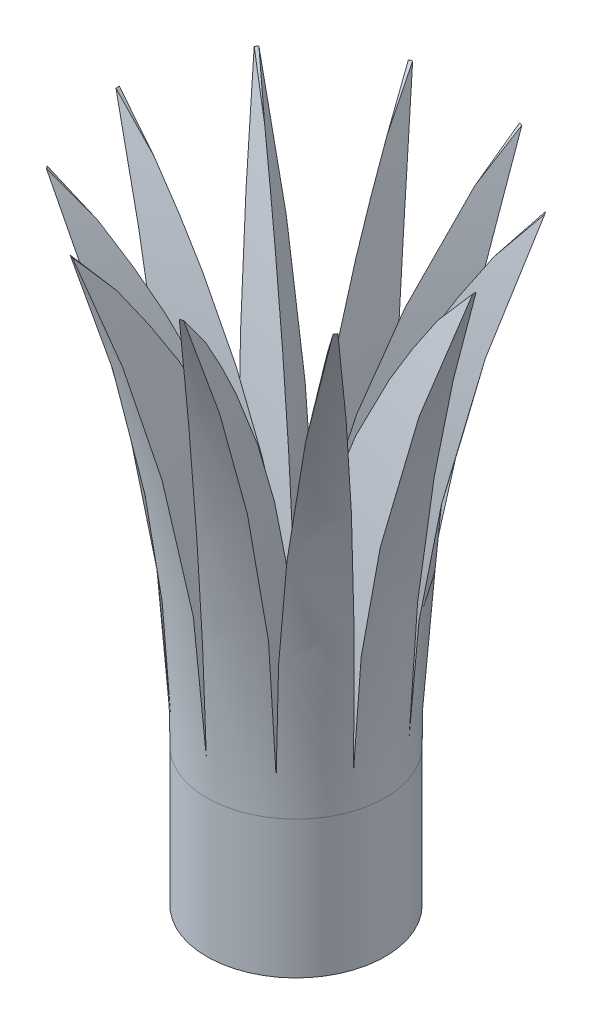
SolidWorks part; units mm, degrees
ref_plane "Plan de face" through (0, 0, 0) normal (0, 0, 1) x (1, 0, 0)
ref_plane "Plan de dessus" through (0, 0, 0) normal (0, 1, 0) x (1, 0, 0)
ref_plane "Plan de droite" through (0, 0, 0) normal (1, 0, 0) x (0, 0, -1)
sketch "Esquisse1" plane through (0, 0, 0) normal (0, 0, 1) x (1, 0, 0)
  line L0 (0, 0) -> (5, 0)
  line L1 (0, 0) -> (0, 35) construction
  line L2 (5, 0) -> (5, 35) construction
  line L3 (5, 8) -> (5, 0)
  line L4 (0, 10) -> (0, 0)
  arc A0 (5, 8) -> (10, 35) centre (80.4, 8) cw
  arc A1 (10, 35) -> (0, 10) centre (36.25, 10) ccw
  dimension "D1" = 5
  dimension "D2" = 35
  dimension "D3" = 8
  dimension "D4" = 10
  dimension "D5" = 10
revolve "Révolution1" add sketch "Esquisse1" angle 360 about L4
sketch "Esquisse2" plane through (0, 0, 0) normal (0, 0, 1) x (1, 0, 0)
  line L0 (-10, 35) -> (10, 35) construction
  line L1 (0, 10) -> (0, 35) construction
  line L2 (-3, 35) -> (3, 35)
  arc A0 (0, 10) -> (-3, 35) centre (-105.6667, 10) ccw
  arc A1 (0, 10) -> (3, 35) centre (105.6667, 10) cw
  dimension "D1" = 3
  dimension "D2" = 3
extrude "Enlèv. mat.-Extru.1" cut sketch "Esquisse2" against normal through all
pattern_circular "Répétition circulaire1" count 10 every 36 about axis through (0, 0, 0) along (0, 1, 0) of "Enlèv. mat.-Extru.1"
chamfer "Chanfrein1" distance 0.5 angle 30 1 edges at (-5, 0, 0)
